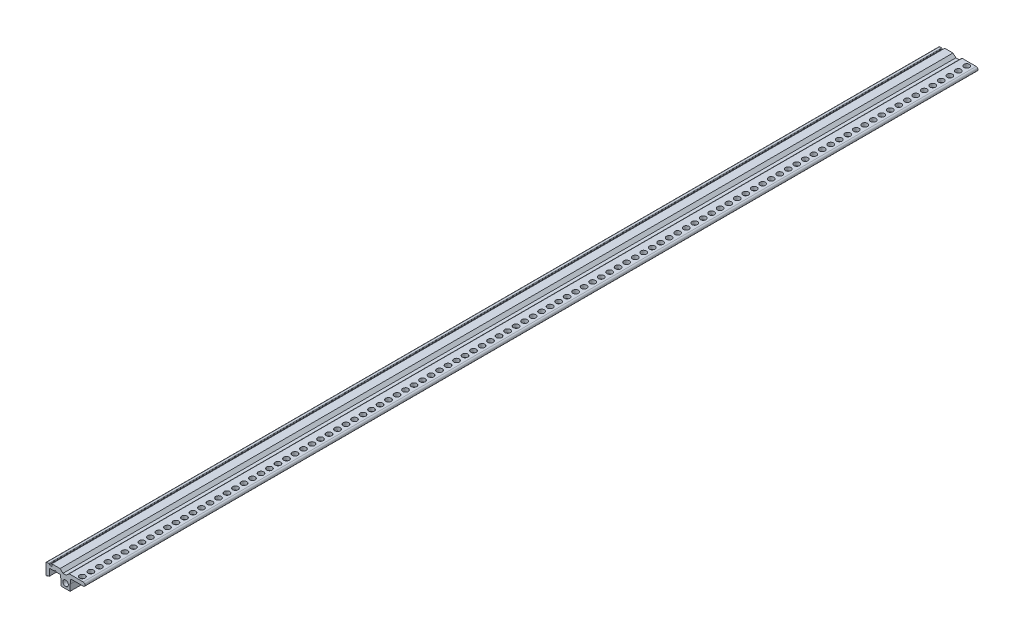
SolidWorks part; units mm, degrees
ref_plane "前视基准面" through (0, 0, 0) normal (0, 0, 1) x (1, 0, 0)
ref_plane "上视基准面" through (0, 0, 0) normal (0, 1, 0) x (1, 0, 0)
ref_plane "右视基准面" through (0, 0, 0) normal (1, 0, 0) x (0, 0, -1)
sketch "草图1" plane through (0, 0, 0) normal (0, 0, 1) x (1, 0, 0)
  line L2 (2426.9819, -3175.6208) -> (2418.5819, -3175.6208)
  line L3 (2418.5819, -3175.6208) -> (2416.8319, -3177.2208)
  line L4 (2416.8319, -3177.2208) -> (2414.8819, -3177.2208)
  line L5 (2414.8819, -3177.2208) -> (2413.1319, -3175.6208)
  line L6 (2413.1319, -3175.6208) -> (2408.1819, -3175.6208)
  line L7 (2408.1819, -3175.6208) -> (2408.1819, -3176.9708)
  line L8 (2408.1819, -3176.9708) -> (2406.6819, -3176.9708)
  line L9 (2406.6819, -3176.9708) -> (2406.6819, -3176.6708)
  line L10 (2406.3819, -3176.3708) -> (2405.1319, -3176.3708)
  line L11 (2404.7319, -3176.7708) -> (2404.7319, -3183.1708)
  line L12 (2405.0319, -3183.4708) -> (2405.2319, -3183.4708)
  line L13 (2406.2711, -3182.8708) -> (2406.6819, -3182.8708)
  line L14 (2406.6819, -3182.8708) -> (2406.6819, -3179.1208)
  line L15 (2407.1819, -3178.6208) -> (2409.8319, -3178.6208)
  line L16 (2410.8319, -3178.6208) -> (2412.9319, -3178.6208)
  line L17 (2413.4319, -3179.1208) -> (2413.4319, -3180.4208)
  line L18 (2413.4319, -3180.4208) -> (2413.7319, -3180.4208)
  line L19 (2413.7319, -3180.4208) -> (2413.7319, -3184.4208)
  line L20 (2413.7319, -3184.4208) -> (2419.1319, -3184.4208)
  line L21 (2419.1319, -3184.4208) -> (2419.1319, -3180.4208)
  line L22 (2419.1319, -3180.4208) -> (2419.4319, -3180.4208)
  line L23 (2419.4319, -3180.4208) -> (2419.4319, -3178.3208)
  line L24 (2419.9319, -3177.8208) -> (2426.9819, -3177.8208)
  circle A0 centre (2416.4319, -3181.5808) radius 1.5
  arc A1 (2406.6819, -3176.6708) -> (2406.3819, -3176.3708) centre (2406.3819, -3176.6708) ccw
  arc A2 (2405.1319, -3176.3708) -> (2404.7319, -3176.7708) centre (2405.1319, -3176.7708) ccw
  arc A3 (2404.7319, -3183.1708) -> (2405.0319, -3183.4708) centre (2405.0319, -3183.1708) ccw
  arc A4 (2405.2319, -3183.4708) -> (2405.4917, -3183.3208) centre (2405.2319, -3183.1708) ccw
  arc A5 (2406.2711, -3182.8708) -> (2405.4917, -3183.3208) centre (2406.2711, -3183.7708) ccw
  arc A6 (2407.1819, -3178.6208) -> (2406.6819, -3179.1208) centre (2407.1819, -3179.1208) ccw
  arc A7 (2410.8319, -3178.6208) -> (2409.8319, -3178.6208) centre (2410.3319, -3178.6208) ccw
  arc A8 (2413.4319, -3179.1208) -> (2412.9319, -3178.6208) centre (2412.9319, -3179.1208) ccw
  arc A9 (2419.9319, -3177.8208) -> (2419.4319, -3178.3208) centre (2419.9319, -3178.3208) ccw
  arc A10 (2426.9819, -3177.8208) -> (2426.9819, -3175.6208) centre (2426.9819, -3176.7208) ccw
  dimension "D1" = 3
extrude "凸台-拉伸1" add sketch "草图1" along normal mid plane 533.4
hole_wizard "M4 螺纹孔1" positions "3D草图1" profile "草图2" tap size "M4" standard "Gb"
sketch3d "3D草图1"
  line L0 (2416.4319, -3181.5808, 266.7) -> (2416.4319, -3181.5808, -266.7) construction
  point P0 (2416.4319, -3181.5808, 266.7)
  point P4 (2416.4319, -3181.5808, -266.7)
sketch "草图2" plane through (2416.4319, -3181.5808, 266.7) normal (1, 0, 0) x (0, -1, 0)
  line L0 (0, 0) -> (0, 15.9914)
  line L1 (0, 15.9914) -> (1.65, 15)
  line L2 (1.65, 15) -> (1.65, 0)
  line L5 (1.65, 0) -> (0, 0)
  line L10 (0, 15.9914) -> (-1.65, 15) construction
  line L11 (0, -6.35) -> (0, 107.95) construction
  dimension "螺纹孔钻头直径" = 3.3
  dimension "螺纹孔钻头深度" = 15
  dimension "导头角度" = 118
sketch "草图3" plane through (0, -3175.6208, 0) normal (0, 1, 0) x (1, 0, 0)
  line L0 (2426.9819, -266.7) -> (2418.5819, -266.7) construction
  line L1 (2428.0819, -266.7) -> (2428.0819, 266.7) construction
  circle A0 centre (2423.9319, -264.16) radius 1.65
  circle A1 centre (2423.9319, -259.08) radius 1.65
  circle A2 centre (2423.9319, -254) radius 1.65
  circle A3 centre (2423.9319, -248.92) radius 1.65
  circle A4 centre (2423.9319, -243.84) radius 1.65
  circle A5 centre (2423.9319, -238.76) radius 1.65
  circle A6 centre (2423.9319, -233.68) radius 1.65
  circle A7 centre (2423.9319, -228.6) radius 1.65
  circle A8 centre (2423.9319, -223.52) radius 1.65
  circle A9 centre (2423.9319, -218.44) radius 1.65
  circle A10 centre (2423.9319, -213.36) radius 1.65
  circle A11 centre (2423.9319, -208.28) radius 1.65
  circle A12 centre (2423.9319, -203.2) radius 1.65
  circle A13 centre (2423.9319, -198.12) radius 1.65
  circle A14 centre (2423.9319, -193.04) radius 1.65
  circle A15 centre (2423.9319, -187.96) radius 1.65
  circle A16 centre (2423.9319, -182.88) radius 1.65
  circle A17 centre (2423.9319, -177.8) radius 1.65
  circle A18 centre (2423.9319, -172.72) radius 1.65
  circle A19 centre (2423.9319, -167.64) radius 1.65
  circle A20 centre (2423.9319, -162.56) radius 1.65
  circle A21 centre (2423.9319, -157.48) radius 1.65
  circle A22 centre (2423.9319, -152.4) radius 1.65
  circle A23 centre (2423.9319, -147.32) radius 1.65
  circle A24 centre (2423.9319, -142.24) radius 1.65
  circle A25 centre (2423.9319, -137.16) radius 1.65
  circle A26 centre (2423.9319, -132.08) radius 1.65
  circle A27 centre (2423.9319, -127) radius 1.65
  circle A28 centre (2423.9319, -121.92) radius 1.65
  circle A29 centre (2423.9319, -116.84) radius 1.65
  circle A30 centre (2423.9319, -111.76) radius 1.65
  circle A31 centre (2423.9319, -106.68) radius 1.65
  circle A32 centre (2423.9319, -101.6) radius 1.65
  circle A33 centre (2423.9319, -96.52) radius 1.65
  circle A34 centre (2423.9319, -91.44) radius 1.65
  circle A35 centre (2423.9319, -86.36) radius 1.65
  circle A36 centre (2423.9319, -81.28) radius 1.65
  circle A37 centre (2423.9319, -76.2) radius 1.65
  circle A38 centre (2423.9319, -71.12) radius 1.65
  circle A39 centre (2423.9319, -66.04) radius 1.65
  circle A40 centre (2423.9319, -60.96) radius 1.65
  circle A41 centre (2423.9319, -55.88) radius 1.65
  circle A42 centre (2423.9319, -50.8) radius 1.65
  circle A43 centre (2423.9319, -45.72) radius 1.65
  circle A44 centre (2423.9319, -40.64) radius 1.65
  circle A45 centre (2423.9319, -35.56) radius 1.65
  circle A46 centre (2423.9319, -30.48) radius 1.65
  circle A47 centre (2423.9319, -25.4) radius 1.65
  circle A48 centre (2423.9319, -20.32) radius 1.65
  circle A49 centre (2423.9319, -15.24) radius 1.65
  circle A50 centre (2423.9319, -10.16) radius 1.65
  circle A51 centre (2423.9319, -5.08) radius 1.65
  circle A52 centre (2423.9319, 0) radius 1.65
  circle A53 centre (2423.9319, 5.08) radius 1.65
  circle A54 centre (2423.9319, 10.16) radius 1.65
  circle A55 centre (2423.9319, 15.24) radius 1.65
  circle A56 centre (2423.9319, 20.32) radius 1.65
  circle A57 centre (2423.9319, 25.4) radius 1.65
  circle A58 centre (2423.9319, 30.48) radius 1.65
  circle A59 centre (2423.9319, 35.56) radius 1.65
  circle A60 centre (2423.9319, 40.64) radius 1.65
  circle A61 centre (2423.9319, 45.72) radius 1.65
  circle A62 centre (2423.9319, 50.8) radius 1.65
  circle A63 centre (2423.9319, 55.88) radius 1.65
  circle A64 centre (2423.9319, 60.96) radius 1.65
  circle A65 centre (2423.9319, 66.04) radius 1.65
  circle A66 centre (2423.9319, 71.12) radius 1.65
  circle A67 centre (2423.9319, 76.2) radius 1.65
  circle A68 centre (2423.9319, 81.28) radius 1.65
  circle A69 centre (2423.9319, 86.36) radius 1.65
  circle A70 centre (2423.9319, 91.44) radius 1.65
  circle A71 centre (2423.9319, 96.52) radius 1.65
  circle A72 centre (2423.9319, 101.6) radius 1.65
  circle A73 centre (2423.9319, 106.68) radius 1.65
  circle A74 centre (2423.9319, 111.76) radius 1.65
  circle A75 centre (2423.9319, 116.84) radius 1.65
  circle A76 centre (2423.9319, 121.92) radius 1.65
  circle A77 centre (2423.9319, 127) radius 1.65
  circle A78 centre (2423.9319, 132.08) radius 1.65
  circle A79 centre (2423.9319, 137.16) radius 1.65
  circle A80 centre (2423.9319, 142.24) radius 1.65
  circle A81 centre (2423.9319, 147.32) radius 1.65
  circle A82 centre (2423.9319, 152.4) radius 1.65
  circle A83 centre (2423.9319, 157.48) radius 1.65
  circle A84 centre (2423.9319, 162.56) radius 1.65
  circle A85 centre (2423.9319, 167.64) radius 1.65
  circle A86 centre (2423.9319, 172.72) radius 1.65
  circle A87 centre (2423.9319, 177.8) radius 1.65
  circle A88 centre (2423.9319, 182.88) radius 1.65
  circle A89 centre (2423.9319, 187.96) radius 1.65
  circle A90 centre (2423.9319, 193.04) radius 1.65
  circle A91 centre (2423.9319, 198.12) radius 1.65
  circle A92 centre (2423.9319, 203.2) radius 1.65
  circle A93 centre (2423.9319, 208.28) radius 1.65
  circle A94 centre (2423.9319, 213.36) radius 1.65
  circle A95 centre (2423.9319, 218.44) radius 1.65
  circle A96 centre (2423.9319, 223.52) radius 1.65
  circle A97 centre (2423.9319, 228.6) radius 1.65
  circle A98 centre (2423.9319, 233.68) radius 1.65
  circle A99 centre (2423.9319, 238.76) radius 1.65
  circle A100 centre (2423.9319, 243.84) radius 1.65
  circle A101 centre (2423.9319, 248.92) radius 1.65
  circle A102 centre (2423.9319, 254) radius 1.65
  circle A103 centre (2423.9319, 259.08) radius 1.65
  circle A104 centre (2423.9319, 264.16) radius 1.65
extrude "切除-拉伸1" cut sketch "草图3" against normal blind 431.8
sketch "草图4" plane through (2404.7319, 0, 0) normal (-1, 0, 0) x (0, 0, 1)
  line L0 (-266.7, -3176.7708) -> (-266.7, -3183.1708) construction
  line L1 (266.7, -3175.6208) -> (-266.7, -3175.6208) construction
  circle A0 centre (-261.62, -3180.8708) radius 1
  circle A1 centre (-256.54, -3180.8708) radius 1
  circle A2 centre (-251.46, -3180.8708) radius 1
  circle A3 centre (-246.38, -3180.8708) radius 1
  circle A4 centre (-241.3, -3180.8708) radius 1
  circle A5 centre (-236.22, -3180.8708) radius 1
  circle A6 centre (-231.14, -3180.8708) radius 1
  circle A7 centre (-226.06, -3180.8708) radius 1
  circle A8 centre (-220.98, -3180.8708) radius 1
  circle A9 centre (-215.9, -3180.8708) radius 1
  circle A10 centre (-210.82, -3180.8708) radius 1
  circle A11 centre (-205.74, -3180.8708) radius 1
  circle A12 centre (-200.66, -3180.8708) radius 1
  circle A13 centre (-195.58, -3180.8708) radius 1
  circle A14 centre (-190.5, -3180.8708) radius 1
  circle A15 centre (-185.42, -3180.8708) radius 1
  circle A16 centre (-180.34, -3180.8708) radius 1
  circle A17 centre (-175.26, -3180.8708) radius 1
  circle A18 centre (-170.18, -3180.8708) radius 1
  circle A19 centre (-165.1, -3180.8708) radius 1
  circle A20 centre (-160.02, -3180.8708) radius 1
  circle A21 centre (-154.94, -3180.8708) radius 1
  circle A22 centre (-149.86, -3180.8708) radius 1
  circle A23 centre (-144.78, -3180.8708) radius 1
  circle A24 centre (-139.7, -3180.8708) radius 1
  circle A25 centre (-134.62, -3180.8708) radius 1
  circle A26 centre (-129.54, -3180.8708) radius 1
  circle A27 centre (-124.46, -3180.8708) radius 1
  circle A28 centre (-119.38, -3180.8708) radius 1
  circle A29 centre (-114.3, -3180.8708) radius 1
  circle A30 centre (-109.22, -3180.8708) radius 1
  circle A31 centre (-104.14, -3180.8708) radius 1
  circle A32 centre (-99.06, -3180.8708) radius 1
  circle A33 centre (-93.98, -3180.8708) radius 1
  circle A34 centre (-88.9, -3180.8708) radius 1
  circle A35 centre (-83.82, -3180.8708) radius 1
  circle A36 centre (-78.74, -3180.8708) radius 1
  circle A37 centre (-73.66, -3180.8708) radius 1
  circle A38 centre (-68.58, -3180.8708) radius 1
  circle A39 centre (-63.5, -3180.8708) radius 1
  circle A40 centre (-58.42, -3180.8708) radius 1
  circle A41 centre (-53.34, -3180.8708) radius 1
  circle A42 centre (-48.26, -3180.8708) radius 1
  circle A43 centre (-43.18, -3180.8708) radius 1
  circle A44 centre (-38.1, -3180.8708) radius 1
  circle A45 centre (-33.02, -3180.8708) radius 1
  circle A46 centre (-27.94, -3180.8708) radius 1
  circle A47 centre (-22.86, -3180.8708) radius 1
  circle A48 centre (-17.78, -3180.8708) radius 1
  circle A49 centre (-12.7, -3180.8708) radius 1
  circle A50 centre (-7.62, -3180.8708) radius 1
  circle A51 centre (-2.54, -3180.8708) radius 1
  circle A52 centre (2.54, -3180.8708) radius 1
  circle A53 centre (7.62, -3180.8708) radius 1
  circle A54 centre (12.7, -3180.8708) radius 1
  circle A55 centre (17.78, -3180.8708) radius 1
  circle A56 centre (22.86, -3180.8708) radius 1
  circle A57 centre (27.94, -3180.8708) radius 1
  circle A58 centre (33.02, -3180.8708) radius 1
  circle A59 centre (38.1, -3180.8708) radius 1
  circle A60 centre (43.18, -3180.8708) radius 1
  circle A61 centre (48.26, -3180.8708) radius 1
  circle A62 centre (53.34, -3180.8708) radius 1
  circle A63 centre (58.42, -3180.8708) radius 1
  circle A64 centre (63.5, -3180.8708) radius 1
  circle A65 centre (68.58, -3180.8708) radius 1
  circle A66 centre (73.66, -3180.8708) radius 1
  circle A67 centre (78.74, -3180.8708) radius 1
  circle A68 centre (83.82, -3180.8708) radius 1
  circle A69 centre (88.9, -3180.8708) radius 1
  circle A70 centre (93.98, -3180.8708) radius 1
  circle A71 centre (99.06, -3180.8708) radius 1
  circle A72 centre (104.14, -3180.8708) radius 1
  circle A73 centre (109.22, -3180.8708) radius 1
  circle A74 centre (114.3, -3180.8708) radius 1
  circle A75 centre (119.38, -3180.8708) radius 1
  circle A76 centre (124.46, -3180.8708) radius 1
  circle A77 centre (129.54, -3180.8708) radius 1
  circle A78 centre (134.62, -3180.8708) radius 1
  circle A79 centre (139.7, -3180.8708) radius 1
  circle A80 centre (144.78, -3180.8708) radius 1
  circle A81 centre (149.86, -3180.8708) radius 1
  circle A82 centre (154.94, -3180.8708) radius 1
  circle A83 centre (160.02, -3180.8708) radius 1
  circle A84 centre (165.1, -3180.8708) radius 1
  circle A85 centre (170.18, -3180.8708) radius 1
  circle A86 centre (175.26, -3180.8708) radius 1
  circle A87 centre (180.34, -3180.8708) radius 1
  circle A88 centre (185.42, -3180.8708) radius 1
  circle A89 centre (190.5, -3180.8708) radius 1
  circle A90 centre (195.58, -3180.8708) radius 1
  circle A91 centre (200.66, -3180.8708) radius 1
  circle A92 centre (205.74, -3180.8708) radius 1
  circle A93 centre (210.82, -3180.8708) radius 1
  circle A94 centre (215.9, -3180.8708) radius 1
  circle A95 centre (220.98, -3180.8708) radius 1
  circle A96 centre (226.06, -3180.8708) radius 1
  circle A97 centre (231.14, -3180.8708) radius 1
  circle A98 centre (236.22, -3180.8708) radius 1
  circle A99 centre (241.3, -3180.8708) radius 1
  circle A100 centre (246.38, -3180.8708) radius 1
  circle A101 centre (251.46, -3180.8708) radius 1
  circle A102 centre (256.54, -3180.8708) radius 1
  circle A103 centre (261.62, -3180.8708) radius 1
extrude "切除-拉伸2" cut sketch "草图4" against normal blind 3
hole_wizard "M2.5 螺纹孔1" positions "3D草图2" profile "草图5" tap size "M2.5" standard "Gb"
sketch3d "3D草图2"
  line L0 (2406.6819, -3180.8708, -261.62) -> (2404.7319, -3180.8708, -261.62) construction
  line L1 (2404.7319, -3183.1708, -266.7) -> (2404.7319, -3183.1708, 266.7) construction
  point P0 (2404.7319, -3180.8708, -261.62)
  dimension "D1" = 533.4
sketch "草图5" plane through (2404.7319, -3180.8708, -261.62) normal (0, 1, 0) x (0, 0, 1)
  line L0 (0, 0) -> (0, 6.9659)
  line L1 (0, 6.9659) -> (1.025, 6.35)
  line L2 (1.025, 6.35) -> (1.025, 0)
  line L5 (1.025, 0) -> (0, 0)
  line L10 (0, 6.9659) -> (-1.025, 6.35) construction
  line L11 (0, -6.35) -> (0, 107.95) construction
  dimension "螺纹孔钻头直径" = 2.05
  dimension "螺纹孔钻头深度" = 6.35
  dimension "导头角度" = 118
pattern_linear "阵列(线性)1" count 84 spacing 5.08 along (0, 0, 1) of "M2.5 螺纹孔1"
equation "\"D4@草图3\"=\"D1@凸台-拉伸1\"/5.08"
equation "\"D4@草图4\"=\"D1@凸台-拉伸1\"/5.08-1"
